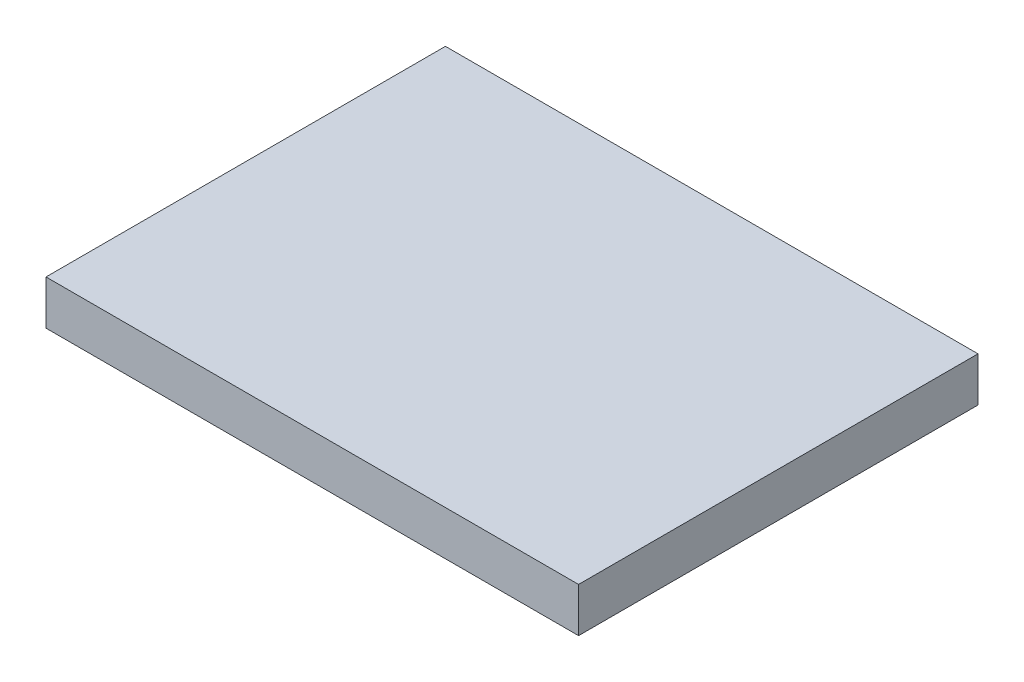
SolidWorks part; units mm, degrees
ref_plane "Plan de face" through (0, 0, 0) normal (0, 0, 1) x (1, 0, 0)
ref_plane "Plan de dessus" through (0, 0, 0) normal (0, 1, 0) x (1, 0, 0)
ref_plane "Plan de droite" through (0, 0, 0) normal (1, 0, 0) x (0, 0, -1)
sketch "Esquisse1" plane through (0, 0, 0) normal (0, 0, 1) x (1, 0, 0)
  line L1 (-60, 1316.5) -> (60, 1316.5)
  line L2 (-60, 1316.5) -> (-60, 1306.5)
  line L3 (-60, 1306.5) -> (60, 1306.5)
  line L4 (60, 1316.5) -> (60, 1306.5)
  dimension "D1" = 10
extrude "Boss.-Extru.1" add sketch "Esquisse1" along normal up to surface (90 mm away)
